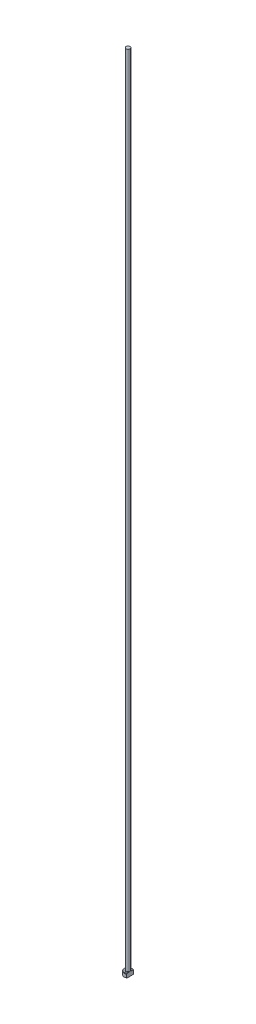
SolidWorks part; units mm, degrees
ref_plane "Front Plane" through (0, 0, 0) normal (0, 0, 1) x (1, 0, 0)
ref_plane "Top Plane" through (0, 0, 0) normal (0, 1, 0) x (1, 0, 0)
ref_plane "Right Plane" through (0, 0, 0) normal (1, 0, 0) x (0, 0, -1)
sketch "Sketch1" plane through (0, 0, 0) normal (0, 0, 1) x (1, 0, 0)
  line L0 (0, 259.9588) -> (0, -15.1925) construction
  line L1 (0, 0) -> (-2, 0)
  line L2 (-2, 0) -> (-2, 2)
  line L3 (-2, 2) -> (-1, 2)
  line L4 (-1, 2) -> (-1, 400)
  line L5 (-1, 400) -> (0, 400)
  line L6 (0, 400) -> (0, 0)
  dimension "L" = 400
  dimension "H" = 4
  dimension "T" = 2
  dimension "D" = 2
revolve "Revolve1" add sketch "Sketch1" angle 360 about L0
chamfer "Chamfer1" distance 0.2 angle 45 2 edges at (0, 2, 2) (0, 0, 2)
fillet "Fillet1" radius 0.2 1 edges at (0, 2, 1)
sketch "Sketch2" plane through (0, 0, 0) normal (0, 1, 0) x (1, 0, 0)
  line L0 (1, 1.7321) -> (1, -1.7321)
  circle A0 centre (0, 0) radius 2 construction
  arc A1 (1, -1.7321) -> (1, 1.7321) centre (0, 0) ccw
  circle A2 centre (0, 0) radius 1 construction
extrude "KEY" cut sketch "Sketch2" along normal through all
